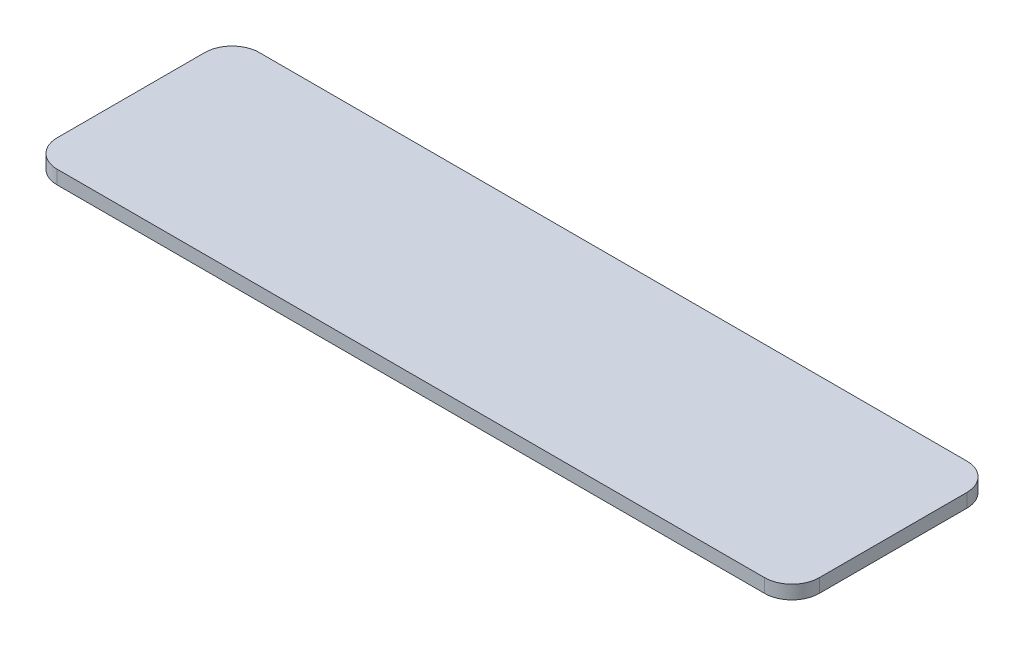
SolidWorks part; units mm, degrees
ref_plane "前视基准面" through (0, 0, 0) normal (0, 0, 1) x (1, 0, 0)
ref_plane "上视基准面" through (0, 0, 0) normal (0, 1, 0) x (1, 0, 0)
ref_plane "右视基准面" through (0, 0, 0) normal (1, 0, 0) x (0, 0, -1)
sketch "草图1" plane through (0, 0, 0) normal (0, 1, 0) x (1, 0, 0)
  line L1 (-27.9, 7.4) -> (27.9, 7.4)
  line L2 (-27.9, 7.4) -> (-27.9, -7.4)
  line L3 (-27.9, -7.4) -> (27.9, -7.4)
  line L4 (27.9, 7.4) -> (27.9, -7.4)
  line L5 (-27.9, 7.4) -> (27.9, -7.4) construction
  line L6 (-27.9, -7.4) -> (27.9, 7.4) construction
  point P0 (0, 0)
  dimension "D1" = 55.8
  dimension "D2" = 14.8
base flange "基体-法兰1" sketch "草图1" thickness 1 reverse thickness direction no parameters "D1"=0.7366
fillet "圆角1" radius 2 4 edges at (27.9, -0.5, 7.4) (27.9, -0.5, -7.4) (-27.9, -0.5, -7.4) (-27.9, -0.5, 7.4)
sketch "折弯-线1" [suppressed] plane through (0, 0, 0) normal (0, 1, 0) x (1, 0, 0)
sketch "边界框1" [suppressed] plane through (0, 0, 0) normal (0, 1, 0) x (1, 0, 0)
sheet metal parameters "钣金6" thickness 1 parameters "D1"=0.7366
flat pattern "平板型式6"
sketch "折弯-线2" plane through (0, 0, 0) normal (0, 1, 0) x (1, 0, 0)
sketch3d "边界框2" [suppressed]
  line L0 (-27.9, -7.4, 0) -> (27.9, -7.4, 0) construction
  line L1 (-27.9, 7.4, 0) -> (27.9, 7.4, 0) construction
  line L2 (-27.9, -7.4, 0) -> (-27.9, 7.4, 0) construction
  line L3 (27.9, -7.4, 0) -> (27.9, 7.4, 0) construction
